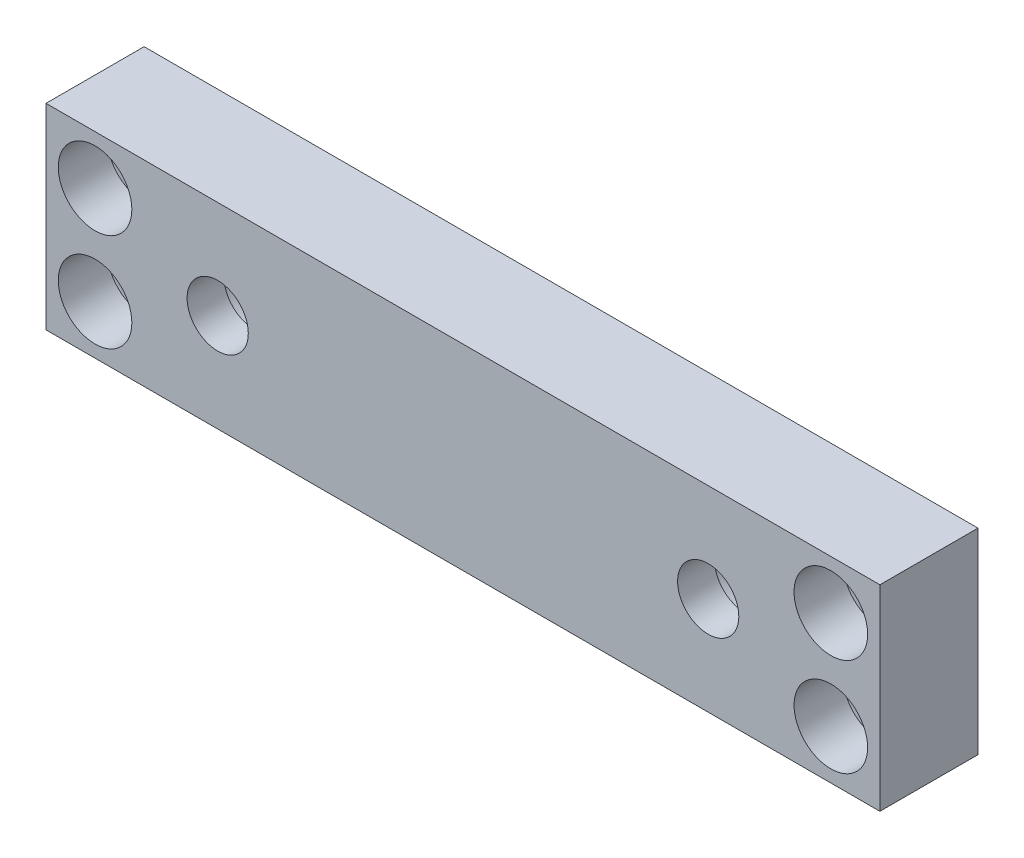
SolidWorks part; units mm, degrees
ref_plane "Front Plane" through (0, 0, 0) normal (0, 0, 1) x (1, 0, 0)
ref_plane "Top Plane" through (0, 0, 0) normal (0, 1, 0) x (1, 0, 0)
ref_plane "Right Plane" through (0, 0, 0) normal (1, 0, 0) x (0, 0, -1)
sketch "Sketch1" plane through (0, 0, 0) normal (0, 0, 1) x (1, 0, 0)
  line L0 (0, 0) -> (24.1189, 0) construction
  line L1 (0, 0) -> (0, 21.7512) construction
  line L2 (-53.975, -12.7) -> (53.975, -12.7)
  line L3 (53.975, -12.7) -> (53.975, 12.7)
  line L4 (53.975, 12.7) -> (-53.975, 12.7)
  line L5 (-53.975, 12.7) -> (-53.975, -12.7)
  circle A0 centre (-31.75, 0) radius 3.9624
  circle A1 centre (31.75, 0) radius 3.9624
  circle A2 centre (-47.625, 6.35) radius 3.175
  circle A3 centre (-47.625, 6.35) radius 4.7625
  circle A4 centre (-47.625, -6.35) radius 3.175
  circle A5 centre (-47.625, -6.35) radius 4.7625
  circle A6 centre (47.625, 6.35) radius 3.175
  circle A7 centre (47.625, 6.35) radius 4.7625
  circle A8 centre (47.625, -6.35) radius 3.175
  circle A9 centre (47.625, -6.35) radius 4.7625
  circle A10 centre (-31.75, 0) radius 6
  circle A11 centre (31.75, 0) radius 6
  dimension "D4" = 7.9248
  dimension "D5" = 9.525
  dimension "D6" = 6.35
  dimension "D9" = 12
  dimension "D1" = 107.95
  dimension "D2" = 25.4
  dimension "D3" = 63.5
  dimension "D7" = 95.25
  dimension "D8" = 12.7
  dimension "D10" = 47.625
  dimension "D11" = 31.75
sketch "Sketch2" plane through (0, 0, 0) normal (0, 0, 1) x (1, 0, 0)
  line L0 (-53.975, -12.7) -> (53.975, -12.7) construction
  line L1 (53.975, -12.7) -> (53.975, 12.7) construction
  line L2 (53.975, 12.7) -> (-53.975, 12.7) construction
  line L3 (-53.975, 12.7) -> (-53.975, -12.7) construction
  line L4 (-53.975, -12.7) -> (53.975, -12.7)
  line L5 (53.975, -12.7) -> (53.975, 12.7)
  line L6 (53.975, 12.7) -> (-53.975, 12.7)
  line L7 (-53.975, 12.7) -> (-53.975, -12.7)
  circle A0 centre (-31.75, 0) radius 3.9624 construction
  circle A1 centre (-47.625, -6.35) radius 3.175 construction
  circle A2 centre (-47.625, 6.35) radius 3.175 construction
  circle A3 centre (31.75, 0) radius 3.9624 construction
  circle A4 centre (47.625, 6.35) radius 3.175 construction
  circle A5 centre (47.625, -6.35) radius 3.175 construction
  circle A6 centre (-31.75, 0) radius 3.9624
  circle A7 centre (-47.625, -6.35) radius 3.175
  circle A8 centre (-47.625, 6.35) radius 3.175
  circle A9 centre (31.75, 0) radius 3.9624
  circle A10 centre (47.625, 6.35) radius 3.175
  circle A11 centre (47.625, -6.35) radius 3.175
extrude "Boss-Extrude1" add sketch "Sketch2" along normal blind 12.7
sketch "Sketch3" plane through (0, 0, 0) normal (0, 0, 1) x (1, 0, 0)
  circle A0 centre (31.75, 0) radius 6 construction
  circle A1 centre (-31.75, 0) radius 6 construction
  circle A2 centre (31.75, 0) radius 6
  circle A3 centre (-31.75, 0) radius 6
extrude "Cut-Extrude1" cut sketch "Sketch3" along normal blind 7.9248
sketch "Sketch4" plane through (0, 0, 0) normal (0, 0, 1) x (1, 0, 0)
  circle A0 centre (-47.625, -6.35) radius 4.7625 construction
  circle A1 centre (-47.625, 6.35) radius 4.7625 construction
  circle A2 centre (47.625, -6.35) radius 4.7625 construction
  circle A3 centre (47.625, 6.35) radius 4.7625 construction
  circle A4 centre (-47.625, -6.35) radius 4.7625
  circle A5 centre (-47.625, 6.35) radius 4.7625
  circle A6 centre (47.625, -6.35) radius 4.7625
  circle A7 centre (47.625, 6.35) radius 4.7625
extrude "Cut-Extrude2" cut sketch "Sketch4" along normal blind 25.4 from offset 6.35
